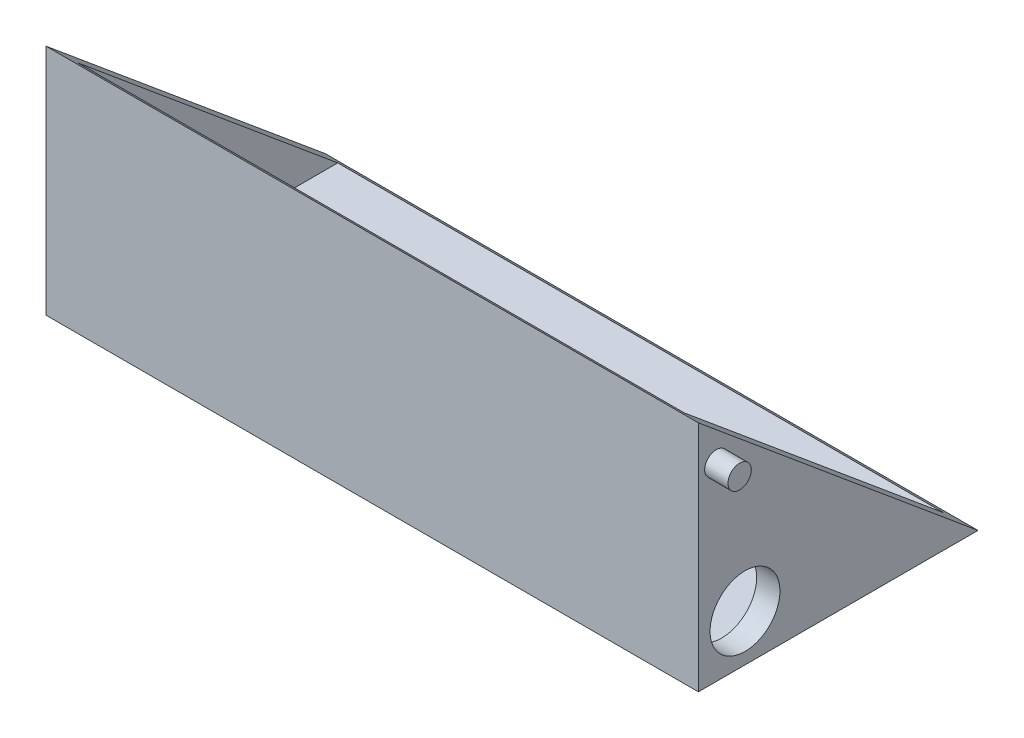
SolidWorks part; units mm, degrees
ref_plane "Front Plane" through (0, 0, 0) normal (0, 0, 1) x (1, 0, 0)
ref_plane "Top Plane" through (0, 0, 0) normal (0, 1, 0) x (1, 0, 0)
ref_plane "Right Plane" through (0, 0, 0) normal (1, 0, 0) x (0, 0, -1)
sketch "Sketch2" plane through (0, 0, 0) normal (1, 0, 0) x (0, 0, -1)
  line L0 (0, 22.9757) -> (0, 0)
  line L1 (0, 0) -> (76.2, 0)
  line L2 (76.2, 0) -> (0, 63.5)
  line L3 (0, 63.5) -> (0, 22.9757)
  dimension "D1" = 76.2
  dimension "D2" = 63.5
extrude "Boss-Extrude1" add sketch "Sketch2" against normal blind 177.8
ref_plane "Plane1" through (0, 63.5, 0) normal (0, -1, 0) x (-1, 0, 0)
sketch "Sketch3" plane through (0, 63.5, 0) normal (0, -1, 0) x (-1, 0, 0)
  line L0 (177.8, 76.2) -> (177.8, 0) construction
  line L1 (171.45, 2.54) -> (6.35, 2.54)
  line L2 (171.45, 2.54) -> (171.45, 81.3993)
  line L3 (171.45, 81.3993) -> (6.35, 81.3993)
  line L4 (6.35, 2.54) -> (6.35, 81.3993)
  line L5 (0, 76.2) -> (0, 0) construction
  line L6 (177.8, 0) -> (0, 0) construction
  dimension "D1" = 6.35
  dimension "D2" = 6.35
  dimension "D3" = 2.54
extrude "Cut-Extrude1" cut sketch "Sketch3" along normal blind 60.96
ref_plane "Plane2" through (-88.9, 0, 0) normal (1, 0, 0) x (0, 0, -1)
sketch "Sketch5" plane through (0, 0, 0) normal (1, 0, 0) x (0, 0, -1)
  line L0 (0, 63.5) -> (0, 0) construction
  line L2 (0, 0) -> (76.2, 0) construction
  circle A0 centre (12.7, 12.7) radius 9.525
  dimension "D1" = 19.05
  dimension "D2" = 12.7
  dimension "D3" = 12.7
extrude "Cut-Extrude3" cut sketch "Sketch5" against normal through all both and the other way through all
sketch "Sketch6" plane through (0, 0, 0) normal (1, 0, 0) x (0, 0, -1)
  circle A0 centre (4.8909, 51.5471) radius 3.175
  dimension "D1" = 6.35
extrude "Boss-Extrude2" add sketch "Sketch6" along normal blind 6.35
